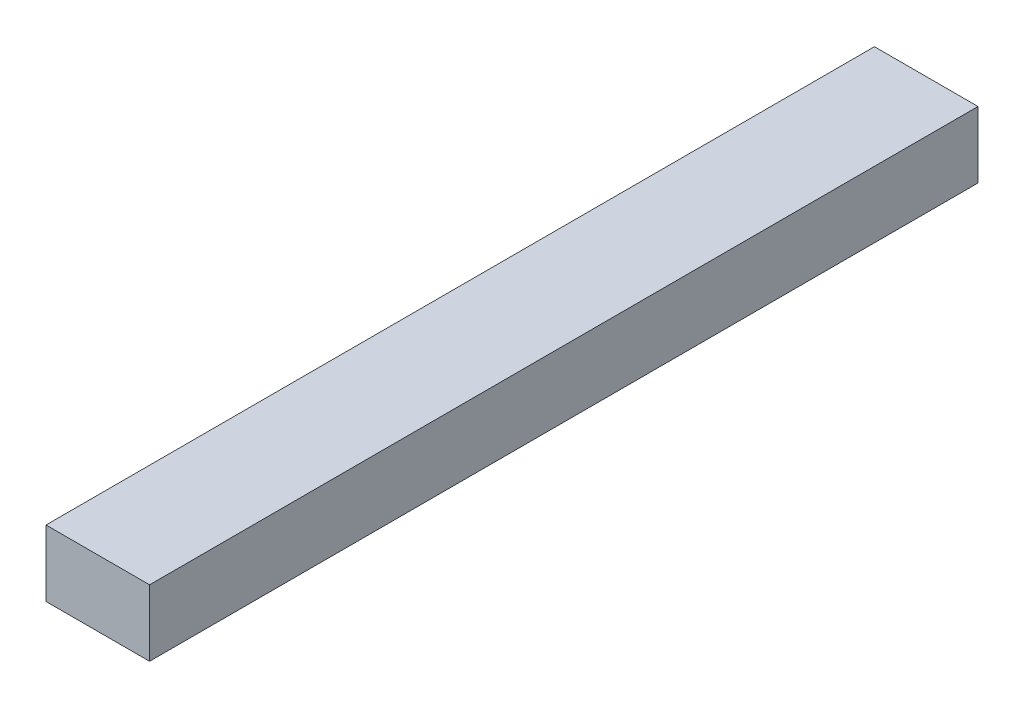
SolidWorks part; units mm, degrees
ref_plane "Alzado" through (0, 0, 0) normal (0, 0, 1) x (1, 0, 0)
ref_plane "Planta" through (0, 0, 0) normal (0, 1, 0) x (1, 0, 0)
ref_plane "Vista lateral" through (0, 0, 0) normal (1, 0, 0) x (0, 0, -1)
sketch "Croquis1" plane through (0, 0, 0) normal (0, 0, 1) x (1, 0, 0)
  line L0 (27.5, 17.5) -> (-27.5, -17.5) construction
  line L1 (-27.5, 17.5) -> (27.5, 17.5)
  line L2 (-27.5, 17.5) -> (-27.5, -17.5)
  line L3 (-27.5, -17.5) -> (27.5, -17.5)
  line L4 (27.5, 17.5) -> (27.5, -17.5)
extrude "Extruir1" add sketch "Croquis1" along normal mid plane 400
sketch "Croquis2" plane through (0, 0, 0) normal (0, 0, 1) x (1, 0, 0)
  line L0 (-25, 16) -> (-25, -16)
  line L1 (-25, -16) -> (25, -16)
  line L2 (25, -16) -> (25, 16)
  line L3 (25, 16) -> (-25, 16)
  line L4 (25, 16) -> (-25, -16) construction
  line L9 (-27.5, 17.5) -> (-27.5, -17.5)
  line L10 (-27.5, -17.5) -> (27.5, -17.5)
  line L11 (27.5, -17.5) -> (27.5, 17.5)
  line L12 (27.5, 17.5) -> (-27.5, 17.5)
  line L13 (-27.5, 17.5) -> (-27.5, -17.5)
  line L14 (-27.5, -17.5) -> (27.5, -17.5)
  line L15 (27.5, -17.5) -> (27.5, 17.5)
  line L16 (27.5, 17.5) -> (-27.5, 17.5)
  dimension "D1" = 0
  dimension "D2" = 50
  dimension "D3" = 32
extrude "Cepillado" cut sketch "Croquis2" against normal through all and the other way through all
